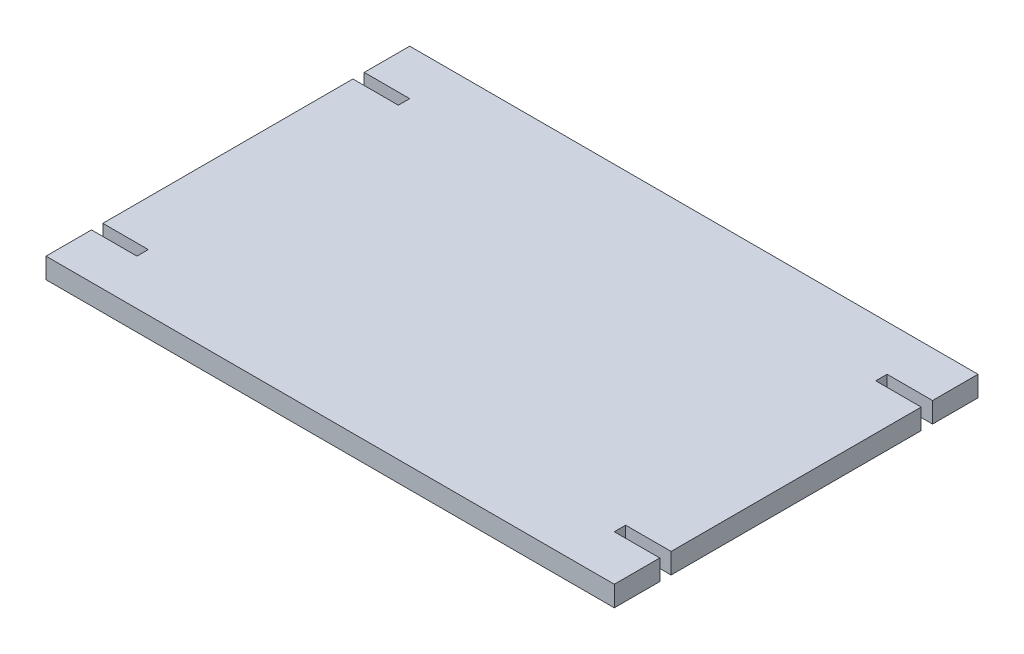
SolidWorks part; units mm, degrees
ref_plane "Front Plane" through (0, 0, 0) normal (0, 0, 1) x (1, 0, 0)
ref_plane "Top Plane" through (0, 0, 0) normal (0, 1, 0) x (1, 0, 0)
ref_plane "Right Plane" through (0, 0, 0) normal (1, 0, 0) x (0, 0, -1)
sketch "Sketch1" plane through (0, 0, 0) normal (0, 1, 0) x (1, 0, 0)
  line L0 (-301.875, 208.2292) -> (198.125, 208.2292)
  line L1 (198.125, 208.2292) -> (198.125, 168.2292)
  line L2 (198.125, 168.2292) -> (158.125, 168.2292)
  line L3 (158.125, 168.2292) -> (158.125, 158.2292)
  line L4 (158.125, 158.2292) -> (198.125, 158.2292)
  line L5 (198.125, 158.2292) -> (198.125, -61.7708)
  line L6 (198.125, -61.7708) -> (158.125, -61.7708)
  line L7 (158.125, -61.7708) -> (158.125, -71.7708)
  line L8 (158.125, -71.7708) -> (198.125, -71.7708)
  line L9 (198.125, -71.7708) -> (198.125, -111.7708)
  line L10 (198.125, -111.7708) -> (-301.875, -111.7708)
  line L11 (-301.875, -111.7708) -> (-301.875, -71.7708)
  line L12 (-301.875, -71.7708) -> (-261.875, -71.7708)
  line L13 (-261.875, -71.7708) -> (-261.875, -61.7708)
  line L14 (-261.875, -61.7708) -> (-301.875, -61.7708)
  line L15 (-301.875, -61.7708) -> (-301.875, 158.2292)
  line L16 (-301.875, 158.2292) -> (-261.875, 158.2292)
  line L17 (-261.875, 158.2292) -> (-261.875, 168.2292)
  line L18 (-261.875, 168.2292) -> (-301.875, 168.2292)
  line L19 (-301.875, 168.2292) -> (-301.875, 208.2292)
  point P18 (-281.875, -71.7708)
  dimension "D1" = 10
  dimension "D2" = 40
  dimension "D3" = 40
  dimension "D4" = 320
  dimension "D5" = 500
  dimension "D6" = 40
extrude "Boss-Extrude1" add sketch "Sketch1" along normal blind 18
